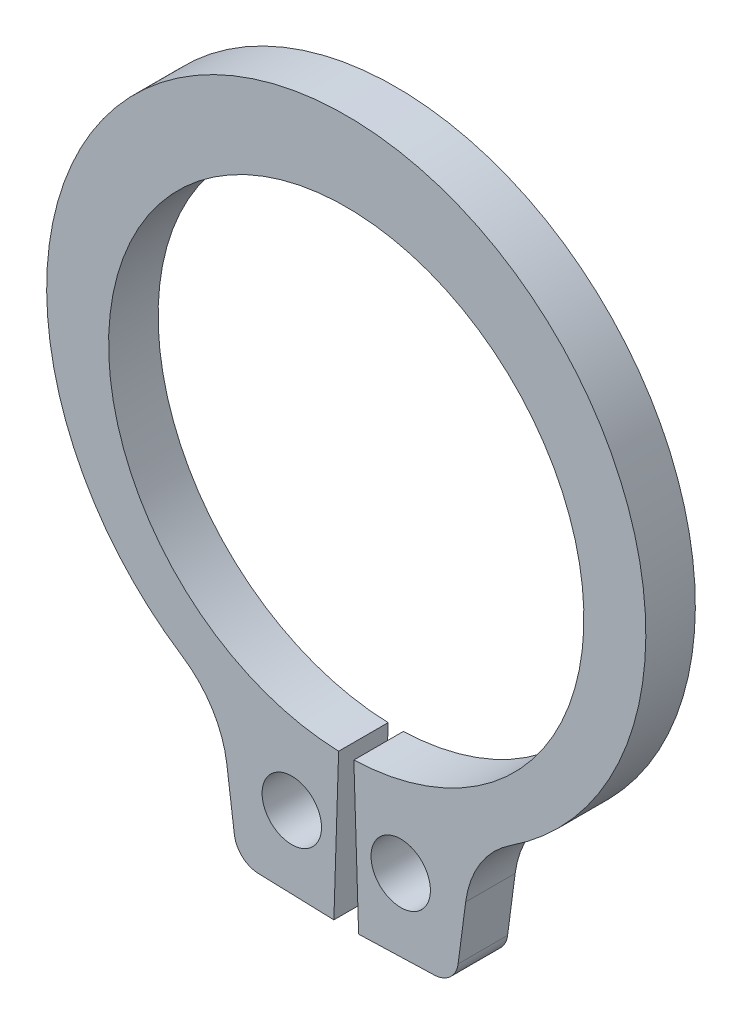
SolidWorks part; units mm, degrees
ref_plane "Plane1" through (0, 0, 0) normal (0, 0, 1) x (1, 0, 0)
ref_plane "Plane2" through (0, 0, 0) normal (0, 1, 0) x (1, 0, 0)
ref_plane "Plane3" through (0, 0, 0) normal (1, 0, 0) x (0, 0, -1)
sketch "Clipboard" plane through (0, 0, 0) normal (0, 0, 1) x (1, 0, 0)
  line L0 (0, 0) -> (1.6, 0)
  line L1 (0, 0) -> (0, 0.96)
  line L2 (0, 0) -> (0, -3)
  circle A0 centre (0, 0) radius 0.6
  circle A1 centre (0, 0) radius 5
  dimension "HoleDia" = 1.2
  dimension "ShaftDia" = 10
  dimension "LargeSection" = 1.6
  dimension "SmallSection" = 0.96
  dimension "LugSection" = 3
sketch "BodySke" plane through (0, 0, 0) normal (0, 0, 1) x (1, 0, 0)
  line L0 (-1.5431, 0) -> (1.5431, 0) construction
  line L1 (0, 0) -> (0, 6.4) construction
  line L2 (0.1538, -4.7975) -> (0.25, -7.796)
  line L3 (-0.1538, -4.7975) -> (-0.25, -7.796)
  line L4 (0, 0) -> (4.4335, -6.4174) construction
  line L5 (0, 0) -> (-4.4335, -6.4174) construction
  line L6 (0.25, -7.796) -> (1.7792, -7.747)
  line L7 (2.4118, -6.1513) -> (2.2589, -7.3125)
  line L8 (-2.4118, -6.1513) -> (-2.2589, -7.3125)
  line L9 (-0.25, -7.796) -> (-1.7792, -7.747)
  circle A0 centre (0, 0) radius 4.8 construction
  arc A1 (0.1538, -4.7975) -> (-0.1538, -4.7975) centre (0, 0) ccw
  arc A2 (3.274, -4.739) -> (-3.274, -4.739) centre (0, 0.3493) ccw construction
  arc A3 (0.25, -7.796) -> (1.9533, -7.5515) centre (0, 0) ccw construction
  arc A4 (3.316, -4.7118) -> (2.4118, -6.1513) centre (4.4335, -6.4174) ccw
  arc A5 (-2.4118, -6.1513) -> (-3.316, -4.7118) centre (-4.4335, -6.4174) ccw
  arc A6 (-1.9533, -7.5515) -> (-0.25, -7.796) centre (0, 0) ccw construction
  arc A7 (3.316, -4.7118) -> (-3.316, -4.7118) centre (0, 0.3493) ccw
  arc A8 (-2.4429, -5.9154) -> (2.4429, -5.9154) centre (0, 0) ccw construction
  circle A9 centre (1.1, -6.3048) radius 0.6
  circle A10 centre (-1.1, -6.3048) radius 0.6
  arc A11 (2.2589, -7.3125) -> (1.7792, -7.747) centre (1.7632, -7.2472) cw
  arc A12 (-2.2589, -7.3125) -> (-1.7792, -7.747) centre (-1.7632, -7.2472) ccw
  point P28 (2.2379, -7.4721)
  point P31 (-2.2379, -7.4721)
  dimension "GrooveDia" = 9.6
  dimension "D3" = 0.5
  dimension "LugRad" = 7.8
  dimension "HoleOffsetRad" = 6.4
  dimension "HoleDia" = 1.2
  dimension "D2" = 15
  dimension "LargeRad" = 6.4
  dimension "SmallRad" = 5.76
  dimension "Gap" = 0.5
  dimension "SmallAngle" = 69.278
  dimension "HoleSpacing" = 2.2
extrude "Body" add sketch "BodySke" against normal blind 1
equation "' \"ShaftDia@Clipboard\" = 10"
equation "' \"Thickness@Body\" = 1"
equation "' \"GrooveDia@BodySke\" = 9.6"
equation "' \"LugSection@Clipboard\" = 3.0"
equation "' \"LargeSection@Clipboard\" = 1.6"
equation "' \"HoleDia@Clipboard\" = 1.2"
equation "\"SmallSection@Clipboard\" =  \"LargeSection@Clipboard\" * 0.6"
equation "\"Gap@BodySke\" =  \"Thickness@Body\" / 2"
equation "\"LargeRad@BodySke\" =  \"GrooveDia@BodySke\" / 2 +  \"LargeSection@Clipboard\""
equation "\"SmallRad@BodySke\" =  \"GrooveDia@BodySke\" / 2 +  \"SmallSection@Clipboard\""
equation "\"LugRad@BodySke\" = \"GrooveDia@BodySke\" / 2 + \"LugSection@Clipboard\""
equation "\"HoleOffsetRad@BodySke\" = (  \"ShaftDia@Clipboard\" / 2 + \"LugRad@BodySke\" ) / 2"
equation "\"HoleSpacing@BodySke\" = \"Gap@BodySke\"  * 2 +  \"HoleDia@Clipboard\""
equation "\"HoleDia@BodySke\" =  \"HoleDia@Clipboard\""
equation "\"SmallAngle@BodySke\" = atn(\"HoleSpacing@BodySke\" / 2 / sqr(\"HoleOffsetRad@BodySke\"  * \"HoleOffsetRad@BodySke\" - (\"HoleSpacing@BodySke\" / 2) * (\"HoleSpacing@BodySke\" / 2) ))  * 7 * ( 180 / 3.141593)"
